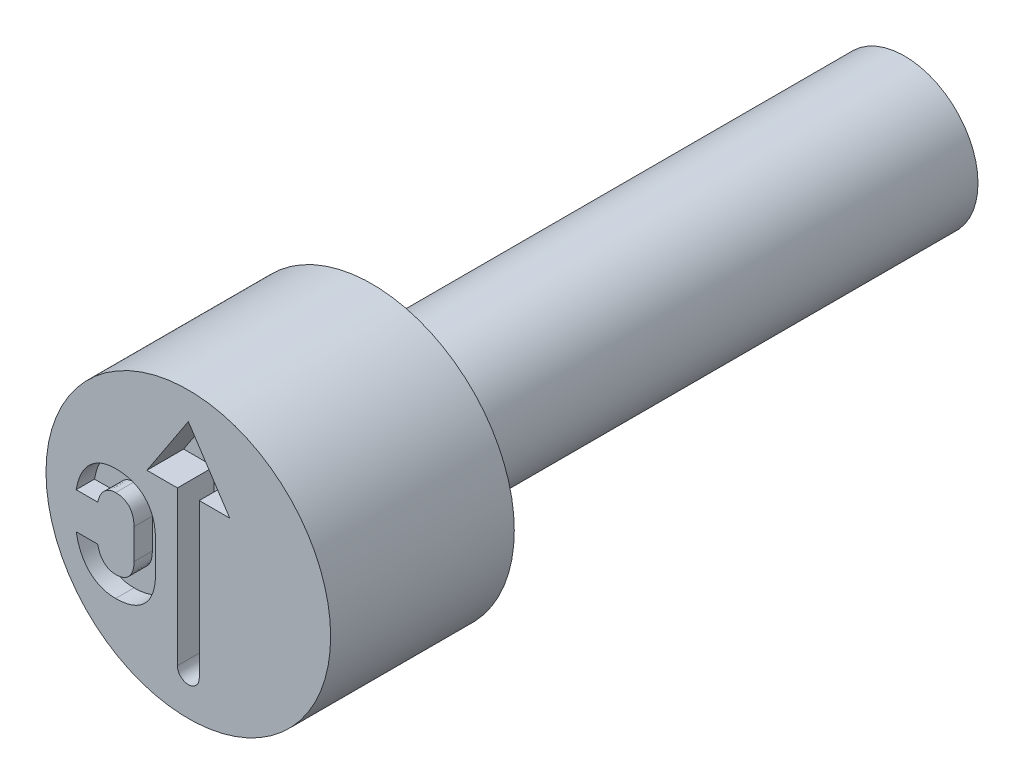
SolidWorks part; units mm, degrees
ref_plane "Front Plane" through (0, 0, 0) normal (0, 0, 1) x (1, 0, 0)
ref_plane "Top Plane" through (0, 0, 0) normal (0, 1, 0) x (1, 0, 0)
ref_plane "Right Plane" through (0, 0, 0) normal (1, 0, 0) x (0, 0, -1)
sketch "Sketch2" plane through (0, 0, 0) normal (1, 0, 0) x (0, 0, -1)
  line L0 (0.4039, 0) -> (50000.4039, 0) construction
  line L6 (0, 1.55) -> (0, 0)
  line L7 (2, 1.55) -> (0, 1.55)
  line L8 (2, 0.8) -> (2, 1.55)
  line L9 (7.8, 0.8) -> (2, 0.8)
  line L10 (7.8, 0) -> (7.8, 0.8)
  line L11 (0, 0) -> (7.8, 0)
  dimension "D1" = 3.1
  dimension "D2" = 1.6
  dimension "D3" = 7.8
  dimension "D4" = 2
revolve "Revolve1" add sketch "Sketch2" angle 360 about L0
sketch "Sketch3" plane through (0, 0, 0) normal (0, 0, 1) x (1, 0, 0)
  line L0 (0, 0) -> (0, 62500) construction
  line L1 (0.119, 0.5665) -> (0.119, -1.1101)
  line L2 (0.4512, 0.5665) -> (0.119, 0.5665)
  line L3 (0, 1.2513) -> (0.4512, 0.5665)
  line L15 (0, 1.2513) -> (-0.4512, 0.5665)
  line L16 (-0.4512, 0.5665) -> (-0.119, 0.5665)
  line L17 (-0.119, 0.5665) -> (-0.119, -1.1101)
  arc A2 (-0.119, -1.1101) -> (0.119, -1.1101) centre (0, -1.1101) ccw
extrude "Cut-Extrude4" cut sketch "Sketch3" against normal blind 0.4
sketch "Sketch4" plane through (0, 0, 0) normal (0, 0, 1) x (1, 0, 0)
  text T0 "C" font "Bahnschrift" height 1.2
  dimension "D1" = 0.8
  dimension "D2" = 0.25
extrude "Cut-Extrude5" cut sketch "Sketch4" against normal blind 0.2
